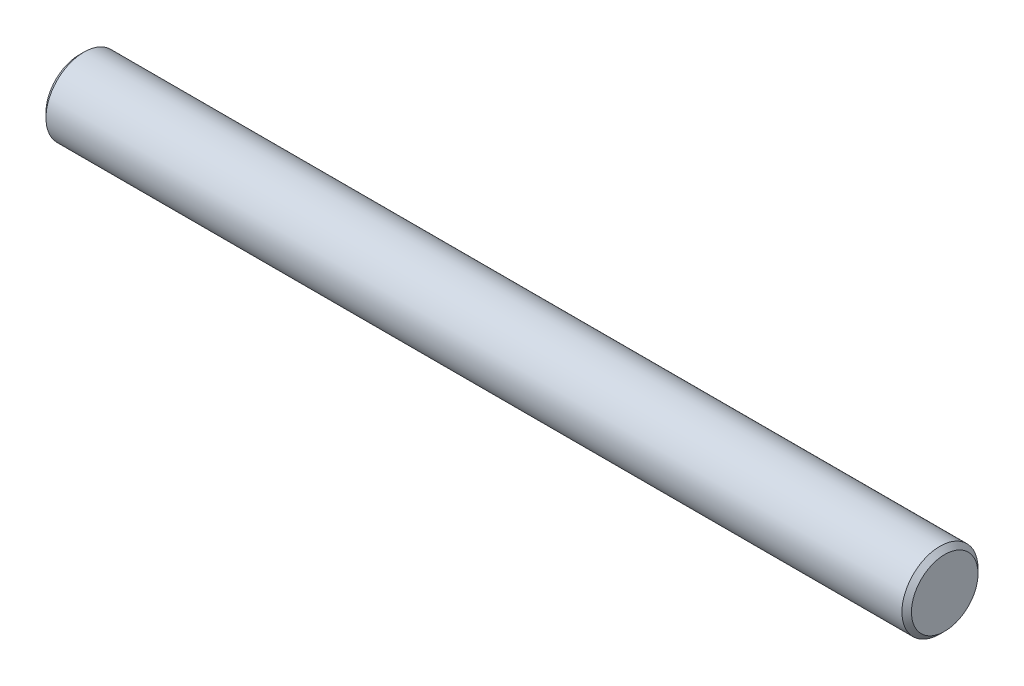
SolidWorks part; units mm, degrees
ref_plane "Front" through (0, 0, 0) normal (0, 0, 1) x (1, 0, 0)
ref_plane "Top" through (0, 0, 0) normal (0, 1, 0) x (1, 0, 0)
ref_plane "Right" through (0, 0, 0) normal (1, 0, 0) x (0, 0, -1)
sketch "Sketch1" plane through (0, 0, 0) normal (1, 0, 0) x (0, 0, -1)
  circle A0 centre (0, 0) radius 8
  dimension "D1" = 16
extrude "Extrude1" add sketch "Sketch1" along normal blind 182
chamfer "Chamfer1" distance 1 angle 45 2 edges at (0, 0, -8) (182, 0, -8)
